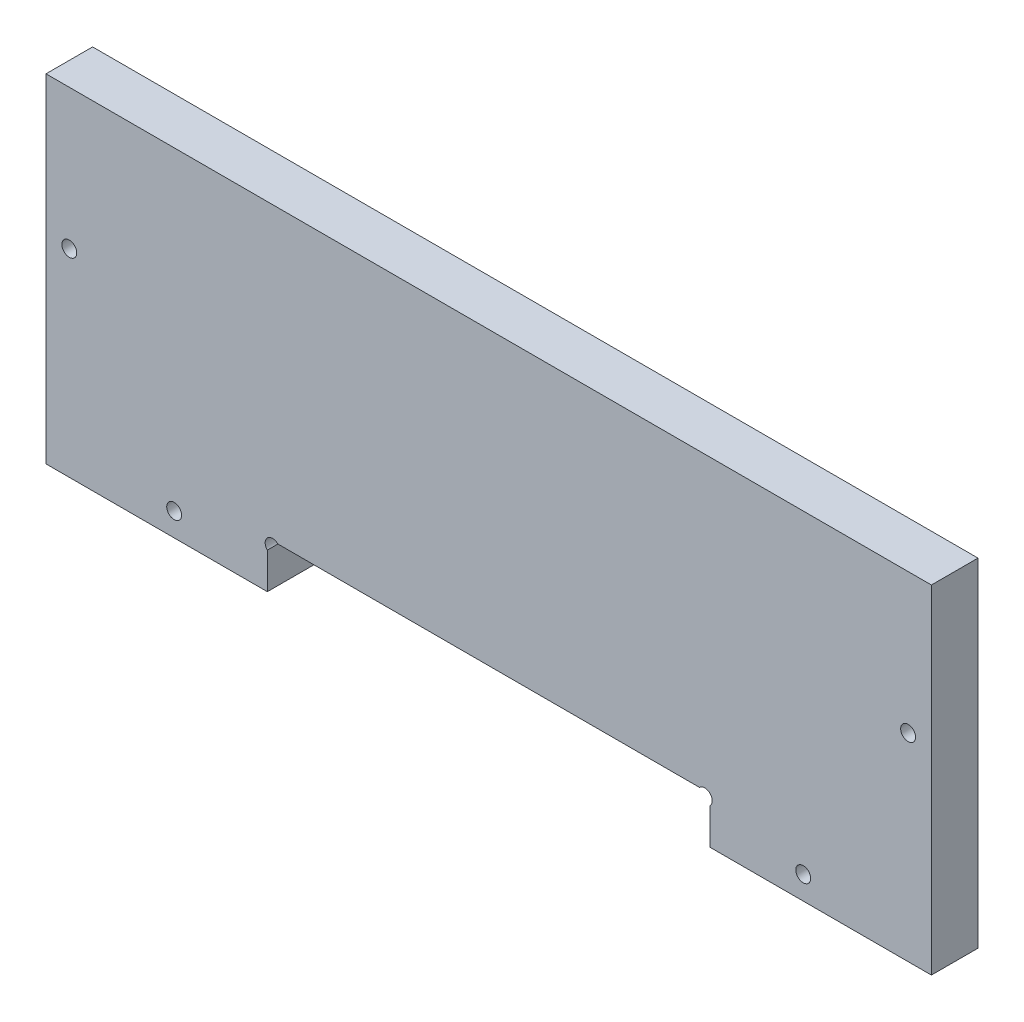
SolidWorks part; units mm, degrees
ref_plane "Plan de face" through (0, 0, 0) normal (0, 0, 1) x (1, 0, 0)
ref_plane "Plan de dessus" through (0, 0, 0) normal (0, 1, 0) x (1, 0, 0)
ref_plane "Plan de droite" through (0, 0, 0) normal (1, 0, 0) x (0, 0, -1)
sketch "Esquisse1" plane through (0, 0, 0) normal (0, 0, 1) x (1, 0, 0)
  line L0 (0, -19.2313) -> (0, 147.5436) construction
  line L1 (14.7016, 0) -> (-274.236, 0) construction
  line L2 (14.7016, 72.5) -> (-274.236, 72.5) construction
  line L3 (-190, -22.5668) -> (-190, 147.5436) construction
  line L4 (-205.6649, 5) -> (-114.1196, 5) construction
  line L5 (-142.5, -15.0619) -> (-142.5, 21.5523) construction
  line L6 (-180, -22.5668) -> (-180, 87.5047) construction
  line L7 (-248.3859, 10) -> (-6.1453, 10) construction
  line L8 (-95, 125.8629) -> (-95, -15.0619) construction
  line L9 (-245.2392, 42.5) -> (-167.7594, 42.5) construction
  line L10 (-185, 45.869) -> (-185, 20.1219) construction
  line L11 (-162.5, -15.0619) -> (-162.5, 8.4403) construction
  line L12 (-142.5, 10) -> (-115.8403, -16.6597) construction
  line L13 (-142.5, 7.7373) -> (-142.5, 0)
  line L14 (-142.5, 0) -> (-190, 0)
  line L15 (-190, 72.5) -> (-190, 0)
  line L16 (0, 72.5) -> (0, 0)
  line L17 (-47.5, 0) -> (0, 0)
  line L18 (-47.5, 7.7373) -> (-47.5, 0)
  line L19 (-49.7627, 10) -> (-140.2373, 10)
  line L20 (0, 72.5) -> (-190, 72.5)
  arc A0 (-140.2373, 10) -> (-142.5, 7.7373) centre (-141.3686, 8.8686) ccw
  circle A1 centre (-162.5, 5) radius 1.6
  circle A2 centre (-185, 42.5) radius 1.6
  circle A3 centre (-5, 42.5) radius 1.6
  circle A4 centre (-27.5, 5) radius 1.6
  arc A5 (-49.7627, 10) -> (-47.5, 7.7373) centre (-48.6314, 8.8686) cw
  point P0 (0, 0)
  dimension "D1" = 190
  dimension "D2" = 72.5
  dimension "D3" = 10
  dimension "D4" = 30
  dimension "D5" = 5
  dimension "D6" = 95
  dimension "D7" = 10
  dimension "D8" = 5
  dimension "D9" = 47.5
  dimension "D10" = 20
  dimension "D11" = 45
extrude "Boss.-Extru.1" add sketch "Esquisse1" along normal blind 10
sketch "Esquisse2" plane through (0, 0, 0) normal (0, 0, -1) x (-1, 0, 0)
  line L0 (190, 98.8621) -> (190, -5.1352) construction
  line L1 (106, 98.8621) -> (106, 3.1795) construction
  line L2 (96, 98.8621) -> (96, 3.1795) construction
  line L3 (101, 87.6134) -> (101, 23.0927) construction
  line L4 (209.5829, 10) -> (110.0426, 10) construction
  line L5 (140.2373, 10) -> (49.7627, 10) construction
  line L6 (209.5829, 47) -> (95.8843, 47) construction
  line L8 (106, 47) -> (80.1592, 21.1592) construction
  line L9 (98.2627, 47) -> (103.7373, 47)
  line L10 (96, 44.7373) -> (96, 10)
  line L11 (106, 44.7373) -> (106, 10)
  line L12 (106, 10) -> (96, 10)
  arc A0 (106, 44.7373) -> (103.7373, 47) centre (104.8686, 45.8686) ccw
  arc A1 (96, 44.7373) -> (98.2627, 47) centre (97.1314, 45.8686) cw
  dimension "D1" = 10
  dimension "D2" = 5
  dimension "D3" = 84
  dimension "D4" = 37
  dimension "D5" = 45
extrude "Enlèv. mat.-Extru.1" cut sketch "Esquisse2" against normal blind 5
